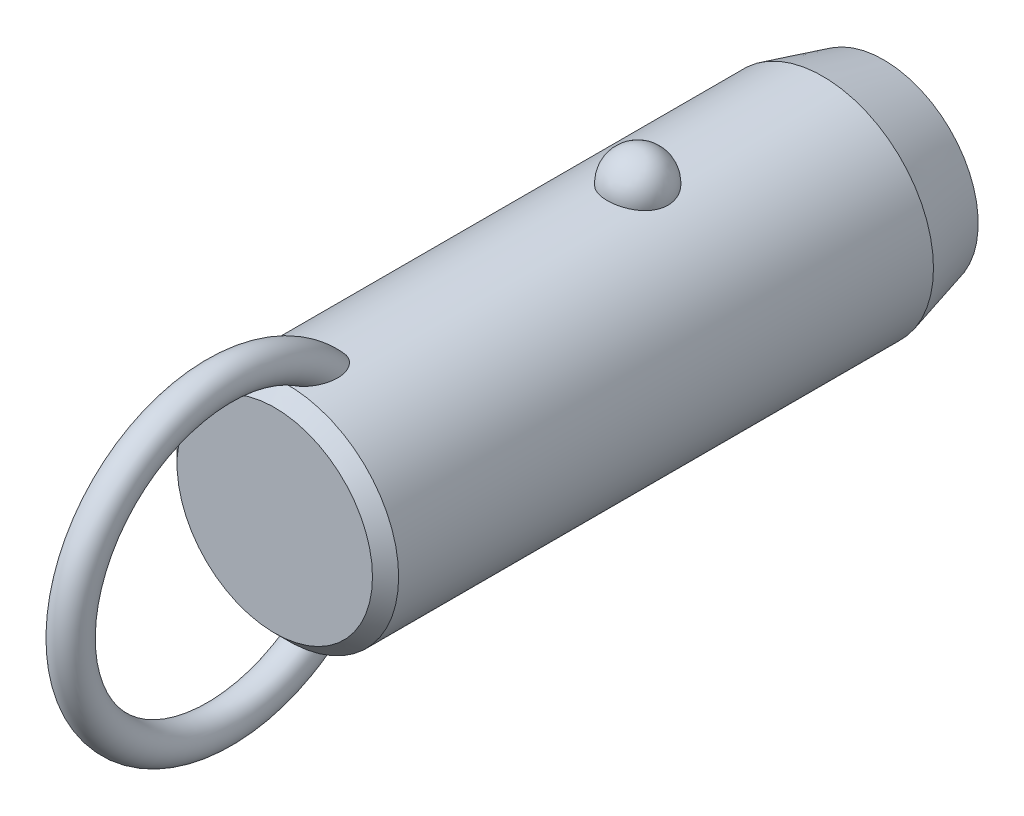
SolidWorks part; units mm, degrees
ref_plane "Front Plane" through (0, 0, 0) normal (0, 0, 1) x (1, 0, 0)
ref_plane "Top Plane" through (0, 0, 0) normal (0, 1, 0) x (1, 0, 0)
ref_plane "Right Plane" through (0, 0, 0) normal (1, 0, 0) x (0, 0, -1)
sketch "Sketch2" plane through (0, 0, 0) normal (0, 0, 1) x (1, 0, 0)
  circle A0 centre (0, 0) radius 12.7
  point P3 (0, 12.7)
  dimension "D1" = 25.4
extrude "Boss-Extrude1" add sketch "Sketch2" along normal blind 25.4
sketch "Sketch3" plane through (0, 0, 0) normal (0, 0, -1) x (-1, 0, 0)
  circle A0 centre (0, 0) radius 12.7
  dimension "D1" = 25.4
extrude "Boss-Extrude2" add sketch "Sketch3" along normal blind 31.7
chamfer "Chamfer1" distance 7 angle 15 1 edges at (-12.7, 0, -31.7)
sketch "Sketch12" plane through (0, 0, 0) normal (1, 0, 0) x (0, 0, -1)
  line L0 (-25.4, 12.7) -> (-25.4, -12.7) construction
  point P0 (-25.4, 0)
sketch "Sketch13" plane through (0, 0, 0) normal (1, 0, 0) x (0, 0, -1)
  circle A0 centre (-44.45, 0) radius 19.05
  point P2 (-25.4, 0)
  dimension "D1" = 38.1
sketch "Sketch14" plane through (0, 0, 0) normal (0, 1, 0) x (1, 0, 0)
  circle A0 centre (0, -27.4) radius 2
  point P2 (0, -25.4)
  dimension "D1" = 4
sweep "Sweep1" add profiles "Sketch14" path "Sketch13"
sketch "Sketch15" plane through (0, 0, 25.4) normal (0, 0, 1) x (1, 0, 0)
  circle A0 centre (0, 0) radius 12.7
  dimension "D1" = 25.4
extrude "Boss-Extrude3" add sketch "Sketch15" along normal blind 12.7
chamfer "Chamfer2" distance 1.5 angle 45 1 edges at (12.7, 0, 38.1)
sketch "Sketch18" plane through (0, 0, 0) normal (1, 0, 0) x (0, 0, -1)
  line L0 (24.7, 12.7) -> (-30.251, 12.7) construction
  line L1 (3.5, 16.2) -> (3.5, 9.2)
  line L2 (-30.251, -12.7) -> (24.7, -12.7) construction
  arc A0 (3.5, 16.2) -> (3.5, 9.2) centre (3.5, 12.7) ccw
  point P4 (0, 12.7)
  dimension "D1" = 28.9
revolve "Revolve1" add sketch "Sketch18" angle 360 about L1
